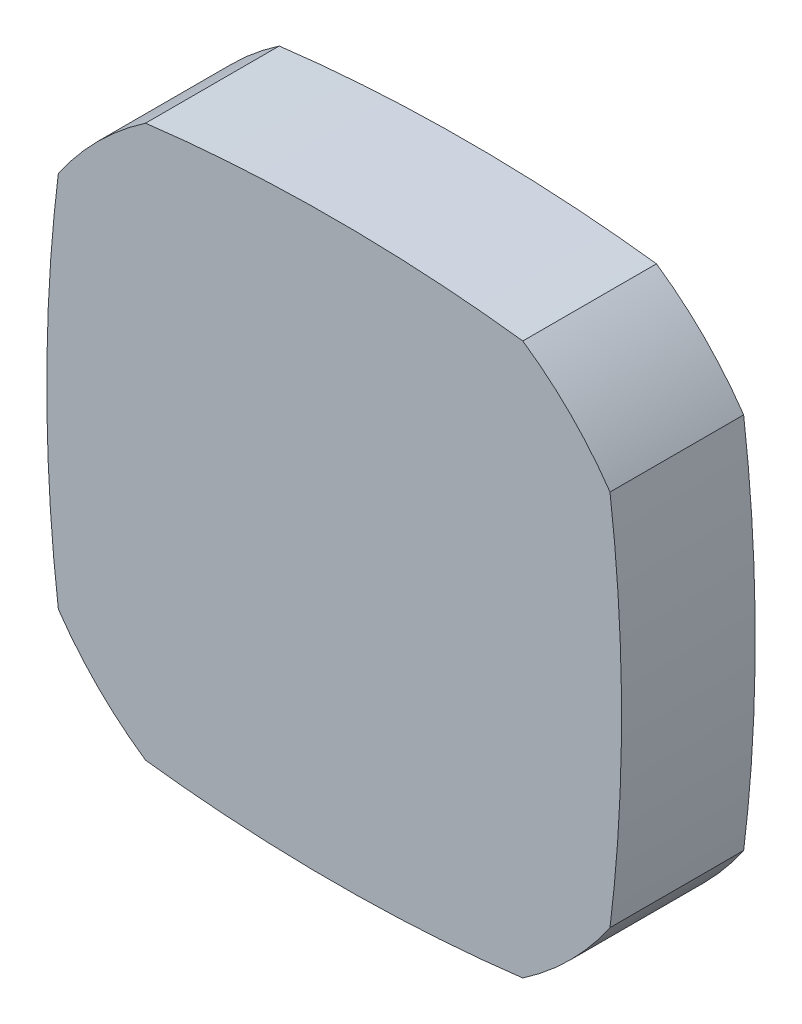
SolidWorks part; units mm, degrees
ref_plane "Ebene vorne" through (0, 0, 0) normal (0, 0, 1) x (1, 0, 0)
ref_plane "Ebene oben" through (0, 0, 0) normal (0, 1, 0) x (1, 0, 0)
ref_plane "Ebene rechts" through (0, 0, 0) normal (1, 0, 0) x (0, 0, -1)
sketch "Skizze1" plane through (0, 0, 0) normal (0, 0, 1) x (1, 0, 0)
  arc A0 (14.1122, 20.6361) -> (20.6361, 14.1122) centre (0, 0) cw
  arc A1 (20.6361, -14.1122) -> (14.1122, -20.6361) centre (0, 0) cw
  arc A2 (-14.1122, -20.6361) -> (-20.6361, -14.1122) centre (0, 0) cw
  arc A3 (-20.6361, 14.1122) -> (-14.1122, 20.6361) centre (0, 0) cw
  point P9 (20.7462, -13.1989)
  point P10 (20.8497, -12.273)
  point P11 (20.9465, -11.3353)
  point P12 (21.0362, -10.3867)
  point P13 (21.1186, -9.4281)
  point P14 (21.1934, -8.4603)
  point P15 (21.2604, -7.4844)
  point P16 (21.3194, -6.5013)
  point P17 (21.3704, -5.5118)
  point P18 (21.413, -4.517)
  point P19 (21.4473, -3.5178)
  point P20 (21.4731, -2.5151)
  point P21 (21.4903, -1.5101)
  point P22 (21.4989, -0.5035)
  point P23 (21.4989, 0.5035)
  point P24 (21.4903, 1.5101)
  point P25 (21.4731, 2.5151)
  point P26 (21.4473, 3.5178)
  point P27 (21.413, 4.517)
  point P28 (21.3704, 5.5118)
  point P29 (21.3194, 6.5013)
  point P30 (21.2604, 7.4844)
  point P31 (21.1934, 8.4603)
  point P32 (21.1186, 9.4281)
  point P33 (21.0362, 10.3867)
  point P34 (20.9465, 11.3353)
  point P35 (20.8497, 12.273)
  point P36 (20.7462, 13.1989)
  point P37 (-13.1989, -20.7462)
  point P38 (-12.273, -20.8497)
  point P39 (-11.3353, -20.9465)
  point P40 (-10.3867, -21.0362)
  point P41 (-9.4281, -21.1186)
  point P42 (-8.4603, -21.1934)
  point P43 (-7.4844, -21.2604)
  point P44 (-6.5013, -21.3194)
  point P45 (-5.5118, -21.3704)
  point P46 (-4.517, -21.413)
  point P47 (-3.5178, -21.4473)
  point P48 (-2.5151, -21.4731)
  point P49 (-1.5101, -21.4903)
  point P50 (-0.5035, -21.4989)
  point P51 (0.5035, -21.4989)
  point P52 (1.5101, -21.4903)
  point P53 (2.5151, -21.4731)
  point P54 (3.5178, -21.4473)
  point P55 (4.517, -21.413)
  point P56 (5.5118, -21.3704)
  point P57 (6.5013, -21.3194)
  point P58 (7.4844, -21.2604)
  point P59 (8.4603, -21.1934)
  point P60 (9.4281, -21.1186)
  point P61 (10.3867, -21.0362)
  point P62 (11.3353, -20.9465)
  point P63 (12.273, -20.8497)
  point P64 (13.1989, -20.7462)
  point P65 (-20.7462, 13.1989)
  point P66 (-20.8497, 12.273)
  point P67 (-20.9465, 11.3353)
  point P68 (-21.0362, 10.3867)
  point P69 (-21.1186, 9.4281)
  point P70 (-21.1934, 8.4603)
  point P71 (-21.2604, 7.4844)
  point P72 (-21.3194, 6.5013)
  point P73 (-21.3704, 5.5118)
  point P74 (-21.413, 4.517)
  point P75 (-21.4473, 3.5178)
  point P76 (-21.4731, 2.5151)
  point P77 (-21.4903, 1.5101)
  point P78 (-21.4989, 0.5035)
  point P79 (-21.4989, -0.5035)
  point P80 (-21.4903, -1.5101)
  point P81 (-21.4731, -2.5151)
  point P82 (-21.4473, -3.5178)
  point P83 (-21.413, -4.517)
  point P84 (-21.3704, -5.5118)
  point P85 (-21.3194, -6.5013)
  point P86 (-21.2604, -7.4844)
  point P87 (-21.1934, -8.4603)
  point P88 (-21.1186, -9.4281)
  point P89 (-21.0362, -10.3867)
  point P90 (-20.9465, -11.3353)
  point P91 (-20.8497, -12.273)
  point P92 (-20.7462, -13.1989)
  point P93 (13.1989, 20.7462)
  point P94 (12.273, 20.8497)
  point P95 (11.3353, 20.9465)
  point P96 (10.3867, 21.0362)
  point P97 (9.4281, 21.1186)
  point P98 (8.4603, 21.1934)
  point P99 (7.4844, 21.2604)
  point P100 (6.5013, 21.3194)
  point P101 (5.5118, 21.3704)
  point P102 (4.517, 21.413)
  point P103 (3.5178, 21.4473)
  point P104 (2.5151, 21.4731)
  point P105 (1.5101, 21.4903)
  point P106 (0.5035, 21.4989)
  point P107 (-0.5035, 21.4989)
  point P108 (-1.5101, 21.4903)
  point P109 (-2.5151, 21.4731)
  point P110 (-3.5178, 21.4473)
  point P111 (-4.517, 21.413)
  point P112 (-5.5118, 21.3704)
  point P113 (-6.5013, 21.3194)
  point P114 (-7.4844, 21.2604)
  point P115 (-8.4603, 21.1934)
  point P116 (-9.4281, 21.1186)
  point P117 (-10.3867, 21.0362)
  point P118 (-11.3353, 20.9465)
  point P119 (-12.273, 20.8497)
  point P120 (-13.1989, 20.7462)
extrude "Linear austragen1" add sketch "Skizze1" along normal blind 10
